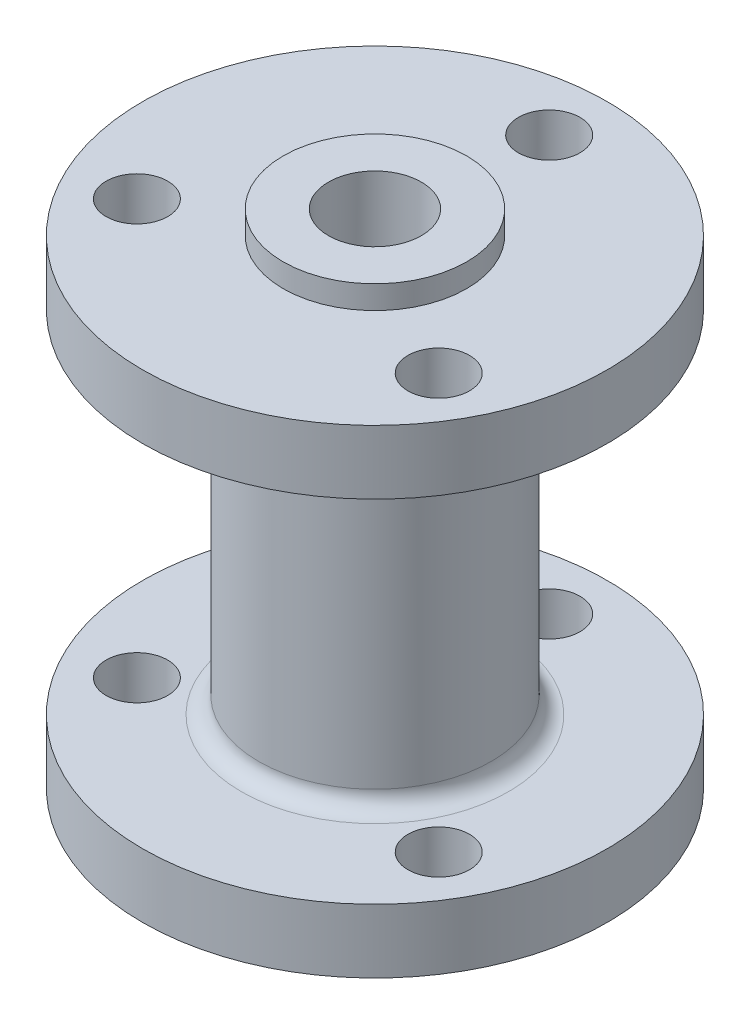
SolidWorks part; units mm, degrees
ref_plane "Front" through (0, 0, 0) normal (0, 0, 1) x (1, 0, 0)
ref_plane "Top" through (0, 0, 0) normal (0, 1, 0) x (1, 0, 0)
ref_plane "Right" through (0, 0, 0) normal (1, 0, 0) x (0, 0, -1)
ref_axis "Axis1" through (0, 50, 0) along (0, -1, 0)
sketch "Sketch1" plane through (0, 0, 0) normal (1, 0, 0) x (0, 0, -1)
  line L0 (0, 22.6) -> (-7.9, 22.6)
  line L1 (-7.9, 22.6) -> (-7.9, 20.6)
  line L2 (-7.9, 20.6) -> (-20, 20.6)
  line L3 (-20, 20.6) -> (-20, 15.1)
  line L4 (-20, 15.1) -> (-10, 15.1)
  line L5 (-10, 15.1) -> (-10, -15.1)
  line L6 (-10, -15.1) -> (-20, -15.1)
  line L7 (-20, -15.1) -> (-20, -20.6)
  line L8 (-20, -20.6) -> (-7.9, -20.6)
  line L9 (-7.9, -20.6) -> (-7.9, -22.6)
  line L10 (-7.9, -22.6) -> (0, -22.6)
  line L11 (0, -22.6) -> (0, 22.6) construction
  line L12 (0, 15.1) -> (-6.5, 15.1)
  line L13 (-6.5, 15.1) -> (-6.5, -15.1)
  line L14 (-6.5, -15.1) -> (0, -15.1)
  line L15 (0, 22.6) -> (0, 15.1)
  line L16 (0, -15.1) -> (0, -22.6)
  point P11 (0, 0)
  point P18 (-6.5, 0)
  dimension "D1" = 20
  dimension "D2" = 5.5
  dimension "D3" = 10
  dimension "D4" = 45.2
  dimension "D5" = 2
  dimension "D6" = 7.9
  dimension "D7" = 3.5
sketch "Sketch2" plane through (0, 0, 0) normal (1, 0, 0) x (0, 0, -1)
  line L12 (0, 22.6) -> (-7.9, 22.6)
  line L13 (-7.9, 22.6) -> (-7.9, 20.6)
  line L14 (-7.9, 20.6) -> (-20, 20.6)
  line L15 (-20, 20.6) -> (-20, 15.1)
  line L16 (-20, 15.1) -> (-10, 15.1)
  line L17 (-10, 15.1) -> (-10, -15.1)
  line L18 (-10, -15.1) -> (-20, -15.1)
  line L19 (-20, -15.1) -> (-20, -20.6)
  line L20 (-20, -20.6) -> (-7.9, -20.6)
  line L21 (-7.9, -20.6) -> (-7.9, -22.6)
  line L22 (-7.9, -22.6) -> (0, -22.6)
  line L23 (0, -22.6) -> (0, -15.1)
  line L24 (0, 22.6) -> (-7.9, 22.6)
  line L25 (-7.9, 22.6) -> (-7.9, 20.6)
  line L26 (-7.9, 20.6) -> (-20, 20.6)
  line L27 (-20, 20.6) -> (-20, 15.1)
  line L28 (-20, 15.1) -> (-10, 15.1)
  line L29 (-10, 15.1) -> (-10, -15.1)
  line L30 (-10, -15.1) -> (-20, -15.1)
  line L31 (-20, -15.1) -> (-20, -20.6)
  line L32 (-20, -20.6) -> (-7.9, -20.6)
  line L33 (-7.9, -20.6) -> (-7.9, -22.6)
  line L34 (-7.9, -22.6) -> (0, -22.6)
  line L40 (0, -22.6) -> (0, -15.1)
  line L41 (0, -15.1) -> (-6.5, -15.1)
  line L42 (0, -15.1) -> (-6.5, -15.1)
  line L43 (-6.5, -15.1) -> (-6.5, 15.1)
  line L44 (-6.5, -15.1) -> (-6.5, 15.1)
  line L45 (-6.5, 15.1) -> (0, 15.1)
  line L46 (-6.5, 15.1) -> (0, 15.1)
  line L47 (0, 15.1) -> (0, 22.6)
  line L48 (0, 15.1) -> (0, 22.6)
  dimension "D1" = 0
revolve "Revolve1" add sketch "Sketch2" angle 360 about axis through (0, 50, 0) along (0, -1, 0)
sketch "Sketch3" plane through (0, 0, 0) normal (0, 1, 0) x (1, 0, 0)
  circle A0 centre (0, 0) radius 15 construction
  point P0 (0, 0)
  point P4 (0, 15)
  dimension "D1" = 30
hole_wizard "Ø8.0mm Dowel Hole1" positions "Sketch4" profile "Sketch5" hole size "Ø8.0" standard "ANSI Metric"
sketch "Sketch4" plane through (0, 22.6, 0) normal (0, 1, 0) x (1, 0, 0)
  point P0 (0, 0)
sketch "Sketch5" plane through (0, 22.6, 0) normal (1, 0, 0) x (0, 0, 1)
  line L0 (0, 0) -> (0, 45.2)
  line L1 (0, 45.2) -> (4, 45.2)
  line L2 (4, 45.2) -> (4, 0)
  line L5 (4, 0) -> (0, 0)
  line L11 (0, -6.35) -> (0, 107.95) construction
  dimension "Thru Hole Dia." = 8
  dimension "Thru Hole Depth" = 45.2
sketch "Sketch11" plane through (0, 0, 0) normal (1, 0, 0) x (0, 0, -1)
  line L0 (0, 15) -> (0, -15)
  line L1 (0, 50) -> (0, -50) construction
  line L2 (0, -15) -> (-6, -15)
  line L3 (-6, -15) -> (-6, 15)
  line L4 (-6, 15) -> (0, 15)
  point P13 (-9.9495, 15.1)
  point P14 (0, 0)
  point P15 (-9, 15.1)
  point P18 (-27.2634, -15.1)
  dimension "D1" = 6
  dimension "D2" = 30
hole_wizard "M5 Clearance Hole1" positions "Sketch6" profile "Sketch7" hole size "M5" standard "ANSI Metric"
sketch "Sketch6" plane through (0, 20.6, 0) normal (0, 1, 0) x (1, 0, 0)
  point P0 (0, 15)
sketch "Sketch7" plane through (0, 20.6, -15) normal (1, 0, 0) x (0, 0, 1)
  line L0 (0, 0) -> (0, 43.2)
  line L1 (0, 43.2) -> (2.65, 43.2)
  line L2 (2.65, 43.2) -> (2.65, 0)
  line L5 (2.65, 0) -> (0, 0)
  line L11 (0, -6.35) -> (0, 107.95) construction
  dimension "Thru Hole Dia." = 5.3
  dimension "Thru Hole Depth" = 43.2
pattern_circular "CirPattern1" count 3 over 360 about axis through (0, 0, 0) along (0, 1, 0) of "M5 Clearance Hole1"
fillet "Fillet1" radius 1.5 2 edges at (0, -15.1, 10) (0, 15.1, 10)
sketch "Sketch8" [suppressed] plane through (0, 0, 0) normal (1, 0, 0) x (0, 0, -1)
  line L0 (7.9, 19.6) -> (-7.9, 19.6) construction
  line L1 (-6.4008, 19.6) -> (-4.2672, 19.6)
  line L2 (-6.4008, 19.6) -> (-6.4008, 18.2792)
  line L3 (-6.4008, 18.2792) -> (-4.2672, 18.2792)
  line L4 (-4.2672, 19.6) -> (-4.2672, 18.2792)
  line L5 (-6.4008, 19.6) -> (-4.2672, 18.2792) construction
  line L6 (-6.4008, 18.2792) -> (-4.2672, 19.6) construction
  line L7 (0, 50) -> (0, -50) construction
  point P4 (-5.334, 18.9396)
  dimension "D1" = 6.4008
  dimension "D2" = 2.1336
  dimension "D3" = 1.3208
sketch "Sketch9" [suppressed] plane through (0, 0, 0) normal (1, 0, 0) x (0, 0, -1)
  line L4 (-4.2672, 19.6) -> (-6.4008, 19.6)
  line L5 (-4.2672, 18.2792) -> (-4.2672, 19.6)
  line L6 (-6.4008, 18.2792) -> (-4.2672, 18.2792)
  line L7 (-6.4008, 19.6) -> (-6.4008, 18.2792)
  line L8 (-4.2672, 19.6) -> (-6.4008, 19.6)
  line L9 (-4.2672, 18.2792) -> (-4.2672, 19.6)
  line L10 (-6.4008, 18.2792) -> (-4.2672, 18.2792)
  line L11 (-6.4008, 19.6) -> (-6.4008, 18.2792)
  dimension "D1" = 0
revolve "Cut-Revolve1" [suppressed] cut sketch "Sketch9" angle 360 about axis through (0, 50, 0) along (0, -1, 0)
sketch "Sketch10" plane through (0, 0, 0) normal (0, 1, 0) x (1, 0, 0)
  circle A0 centre (0, 15) radius 4.25 construction
  circle A1 centre (0, 0) radius 10 construction
  dimension "D1" = 8.5
  dimension "D2" = 20
